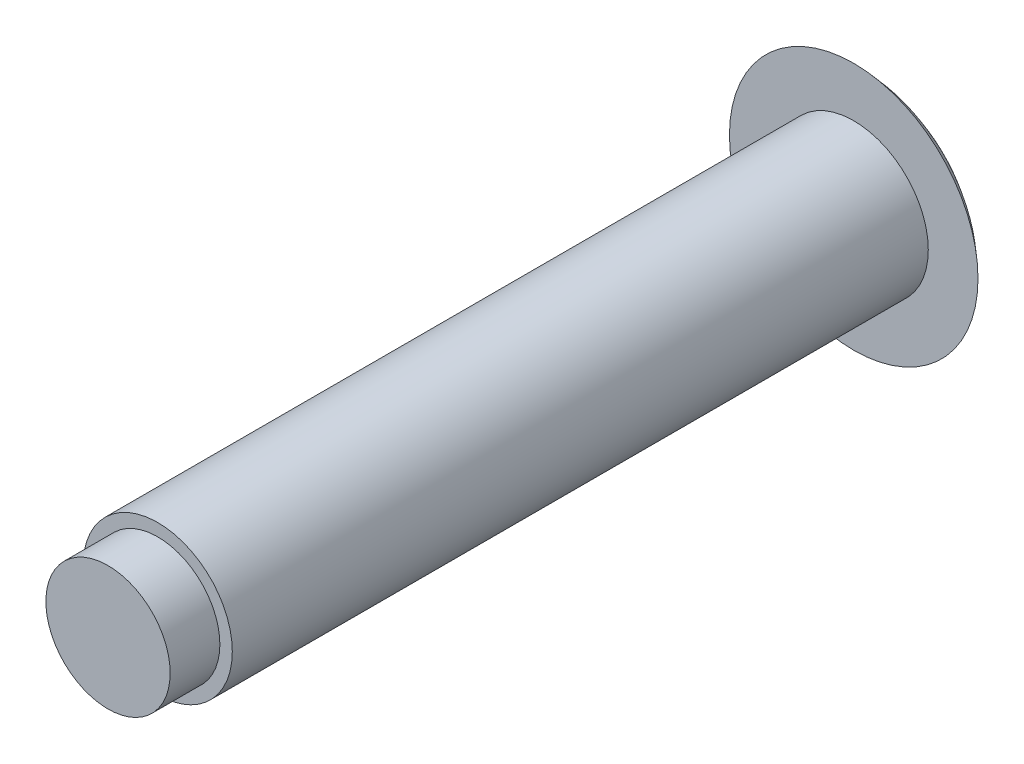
SolidWorks part; units mm, degrees
ref_plane "Plan de face" through (0, 0, 0) normal (0, 0, 1) x (1, 0, 0)
ref_plane "Plan de dessus" through (0, 0, 0) normal (0, 1, 0) x (1, 0, 0)
ref_plane "Plan de droite" through (0, 0, 0) normal (1, 0, 0) x (0, 0, -1)
sketch "Esquisse1" plane through (0, 0, 0) normal (0, 0, 1) x (1, 0, 0)
  circle A0 centre (0, 0) radius 3
  dimension "D1" = 6
extrude "Extrusion1" add sketch "Esquisse1" along normal blind 28
sketch "Esquisse2" plane through (0, 0, 0) normal (0, 1, 0) x (1, 0, 0)
  line L0 (-0.8321, 2) -> (4.1412, 2) construction
  line L1 (3, 0) -> (-3, 0) construction
  line L2 (5, 2.7751) -> (5, -1.6605) construction
  line L3 (-5, 2.4559) -> (-5, -1.8286) construction
  line L4 (0, 0) -> (0, 2)
  line L5 (0, 0) -> (5, 0)
  arc A0 (0, 2) -> (5, 0) centre (0, -5.25) cw
  dimension "D1" = 2
  dimension "D2" = 5
  dimension "D3" = 10
revolve "Révolution1" add sketch "Esquisse2" angle 360 about L4
sketch "Esquisse3" plane through (0, 0, 28) normal (0, 0, 1) x (1, 0, 0)
  circle A0 centre (0, 0) radius 2.5
  dimension "D1" = 5
extrude "Extrusion2" add sketch "Esquisse3" along normal blind 2
